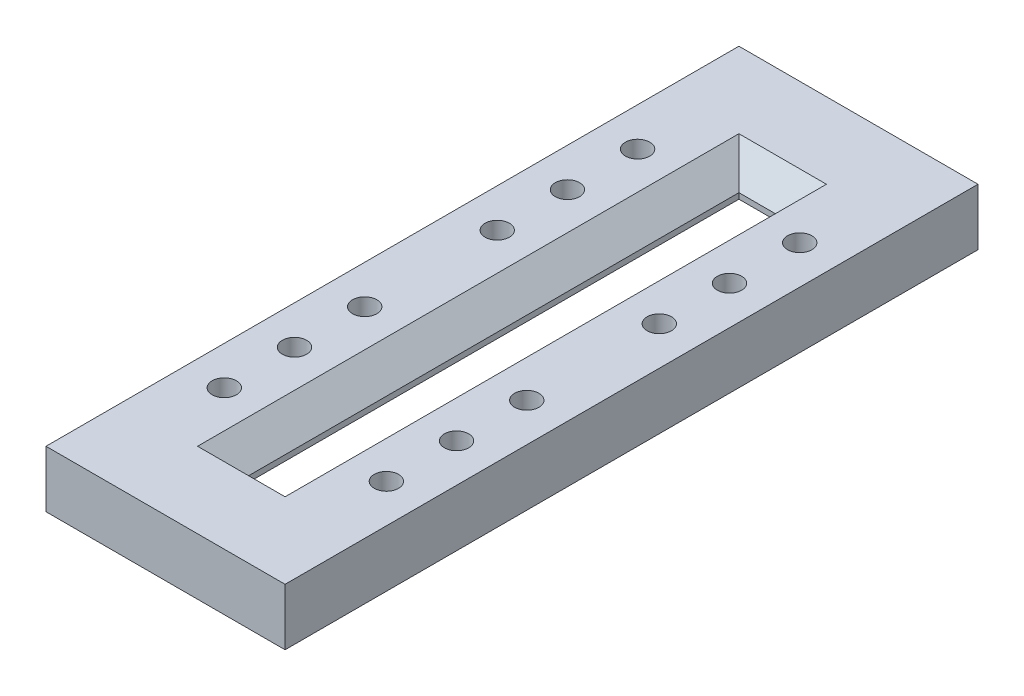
SolidWorks part; units mm, degrees
ref_plane "Front Plane" through (0, 0, 0) normal (1, 0, 0) x (0, 1, 0)
ref_plane "Top Plane" through (0, 0, 0) normal (0, 0, 1) x (0, 1, 0)
ref_plane "Right Plane" through (0, 0, 0) normal (0, 1, 0) x (-1, 0, 0)
sketch "sk 30x2in w weld" plane through (0, 0, 0) normal (0, 1, 0) x (-1, 0, 0)
  line L0 (-92.075, 447.675) -> (92.075, 447.675)
  line L1 (-25.4, 381) -> (25.4, 381)
  line L2 (-25.4, 381) -> (-25.4, -381)
  line L3 (-25.4, -381) -> (25.4, -381)
  line L4 (25.4, 381) -> (25.4, -381)
  line L5 (-25.4, 381) -> (25.4, -381) construction
  line L6 (-25.4, -381) -> (25.4, 381) construction
  line L7 (92.075, 447.675) -> (92.075, -447.675)
  line L8 (-92.075, -447.675) -> (92.075, -447.675)
  line L9 (-92.075, 447.675) -> (-92.075, -447.675)
  point P0 (0, 0)
  dimension "D1" = 50.8
  dimension "D2" = 762
  dimension "D3" = 66.675
sketch "sk block" plane through (0, 0, 0) normal (0, 1, 0) x (-1, 0, 0)
  line L8 (-28.575, 384.175) -> (-28.575, -384.175)
  line L9 (-28.575, -384.175) -> (28.575, -384.175)
  line L10 (28.575, -384.175) -> (28.575, 384.175)
  line L11 (28.575, 384.175) -> (-28.575, 384.175)
  line L12 (-28.575, 384.175) -> (-28.575, -384.175)
  line L13 (-28.575, -384.175) -> (28.575, -384.175)
  line L14 (28.575, -384.175) -> (28.575, 384.175)
  line L15 (28.575, 384.175) -> (-28.575, 384.175)
  line L20 (-187.325, 542.925) -> (-187.325, -542.925)
  line L21 (-187.325, -542.925) -> (187.325, -542.925)
  line L22 (187.325, -542.925) -> (187.325, 542.925)
  line L23 (187.325, 542.925) -> (-187.325, 542.925)
  line L24 (-187.325, 542.925) -> (-187.325, -542.925)
  line L25 (-187.325, -542.925) -> (187.325, -542.925)
  line L26 (187.325, -542.925) -> (187.325, 542.925)
  line L27 (187.325, 542.925) -> (-187.325, 542.925)
  dimension "D1" = 3.175
  dimension "D2" = 161.925
sketch "sk Holes" plane through (0, 0, 0) normal (0, 1, 0) x (-1, 0, 0)
  line L0 (-25.4, 381) -> (25.4, 381) construction
  line L1 (-25.4, -381) -> (25.4, -381) construction
  line L2 (-25.4, 381) -> (-25.4, -381) construction
  circle A0 centre (-127, 323.85) radius 19.05
  circle A1 centre (127, 323.85) radius 19.05
  circle A2 centre (-127, -323.85) radius 19.05
  circle A3 centre (127, -323.85) radius 19.05
  circle A4 centre (-127, 213.85) radius 19.05
  circle A5 centre (127, 213.85) radius 19.05
  circle A6 centre (-127, -213.85) radius 19.05
  circle A7 centre (127, -213.85) radius 19.05
  circle A8 centre (-127, 323.85) radius 41.275 construction
  circle A9 centre (127, 323.85) radius 41.275 construction
  circle A10 centre (-127, 103.85) radius 19.05
  circle A11 centre (127, 103.85) radius 19.05
  circle A12 centre (-127, -103.85) radius 19.05
  circle A13 centre (127, -103.85) radius 19.05
  circle A14 centre (-127, 213.85) radius 34.925 construction
  point P10 (0, 381)
  point P23 (-85.725, 323.85)
  dimension "D1" = 38.1
  dimension "D2" = 38.1
  dimension "D6" = 38.1
  dimension "D7" = 38.1
  dimension "D11" = 82.55
  dimension "D12" = 82.55
  dimension "D13" = 60.325
  dimension "D14" = 69.85
  dimension "D3" = 57.15
  dimension "D4" = 127
  dimension "D5" = 127
  dimension "D8" = 57.15
  dimension "D9" = 3
  dimension "D10" = 3
extrude "Boss-Extrude1" add sketch "sk block" along normal blind 88.9
extrude "Cut-Extrude1" cut sketch "sk Holes" along normal through all
chamfer "Chamfer1" distance 40 angle 45 8 edges at (-28.575, 0, 0) (0, 0, 384.175) (0, 0, -384.175) (28.575, 0, 0) (0, 88.9, -384.175) (28.575, 88.9, 0) (0, 88.9, 384.175) (-28.575, 88.9, 0)
